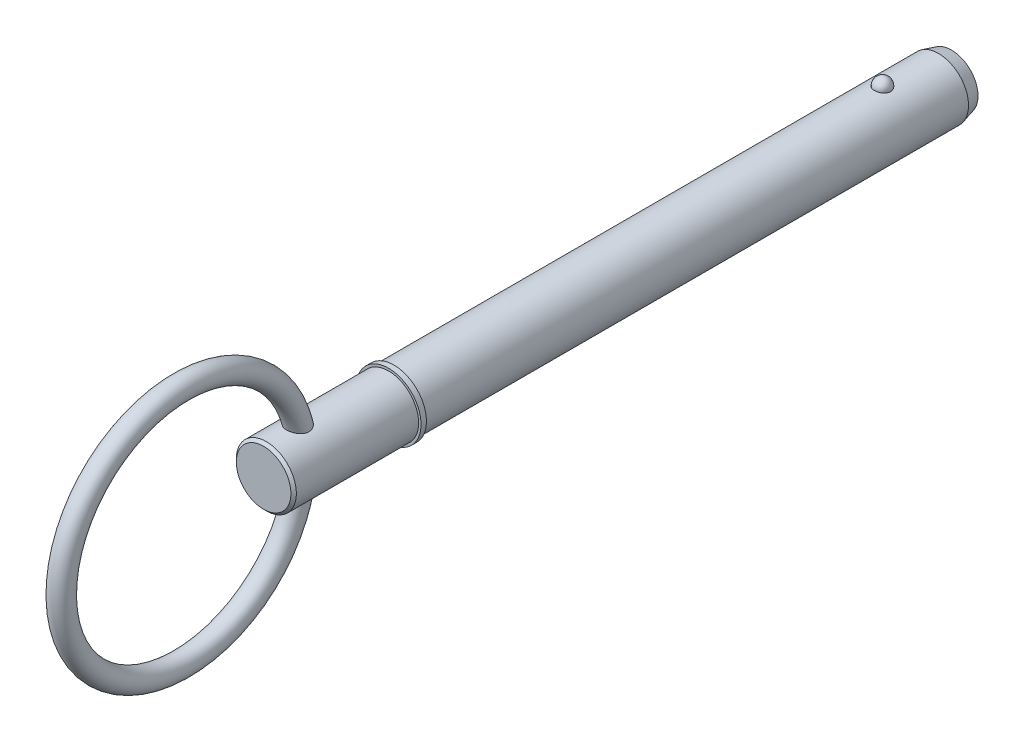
SolidWorks part; units mm, degrees
ref_plane "Front Plane" through (0, 0, 0) normal (0, 0, 1) x (1, 0, 0)
ref_plane "Top Plane" through (0, 0, 0) normal (0, 1, 0) x (1, 0, 0)
ref_plane "Right Plane" through (0, 0, 0) normal (1, 0, 0) x (0, 0, -1)
sketch "Sketch2" plane through (0, 0, 0) normal (0, 0, 1) x (1, 0, 0)
  circle A0 centre (0, 0) radius 5.555
  point P3 (0, 5.555)
  dimension "D1" = 11.11
extrude "Boss-Extrude1" add sketch "Sketch2" along normal blind 88.9
sketch "Sketch3" plane through (0, 0, 0) normal (0, 0, -1) x (-1, 0, 0)
  circle A0 centre (0, 0) radius 5.555
  dimension "D1" = 11.11
extrude "Boss-Extrude2" add sketch "Sketch3" along normal blind 14.27
chamfer "Chamfer1" distance 2.4 angle 15 1 edges at (-5.555, 0, -14.27)
sketch "Sketch18" plane through (0, 0, 0) normal (1, 0, 0) x (0, 0, -1)
  line L0 (11.87, 5.555) -> (-88.9, 5.555) construction
  line L1 (1.49, 7.045) -> (1.49, 4.065)
  line L2 (-88.9, -5.555) -> (11.87, -5.555) construction
  arc A0 (1.49, 7.045) -> (1.49, 4.065) centre (1.49, 5.555) ccw
  point P4 (0, 5.555)
  dimension "D1" = 12.6
revolve "Revolve1" add sketch "Sketch18" angle 360 about L1
sketch "Sketch19" plane through (0, 0, 0) normal (1, 0, 0) x (0, 0, -1)
  line L0 (-33.7288, 0) -> (-46.4542, 0) construction
sketch "Sketch20" plane through (0, 0, 0) normal (1, 0, 0) x (0, 0, -1)
  line L0 (-88.9, 0) -> (-88.9, 6)
  line L1 (-88.9, 5.555) -> (-88.9, -5.555) construction
  line L2 (-88.9, 6) -> (-89.9, 6)
  line L3 (-89.9, 6) -> (-89.9, 0)
  line L4 (-33.7288, 0) -> (-46.4542, 0) construction
  line L5 (-89.9, 0) -> (-88.9, 0)
  dimension "D1" = 6
  dimension "D2" = 1
revolve "Revolve2" add sketch "Sketch20" angle 360 about L0
sketch "Sketch21" plane through (0, 0, 88.9) normal (0, 0, -1) x (-1, 0, 0)
  circle A0 centre (0, 0) radius 5.555
  dimension "D1" = 11.11
extrude "Boss-Extrude3" add sketch "Sketch21" against normal blind 24.13
chamfer "Chamfer2" distance 0.5 angle 45 1 edges at (-5.555, 0, 113.03)
sketch "Sketch23" plane through (0, 0, 0) normal (1, 0, 0) x (0, 0, -1)
  line L0 (-113.03, 5.055) -> (-113.03, -5.055) construction
  circle A0 centre (-128.255, 0) radius 22.225
  point P2 (-106.03, 0)
  dimension "D1" = 44.45
  dimension "D2" = 7
sketch "Sketch24" plane through (0, 0, 0) normal (0, 1, 0) x (1, 0, 0)
  circle A0 centre (0, -106.03) radius 2
  dimension "D1" = 4
sweep "Sweep1" add profiles "Sketch24" path "Sketch23"
